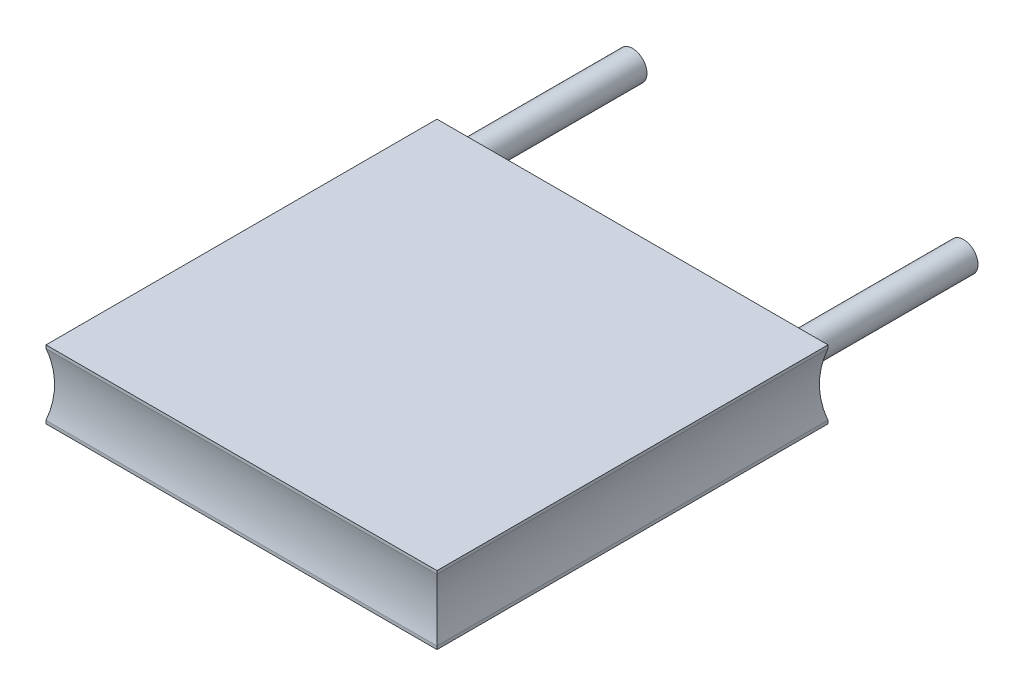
SolidWorks part; units mm, degrees
ref_plane "Front Plane" through (0, 0, 0) normal (0, 0, 1) x (1, 0, 0)
ref_plane "Top Plane" through (0, 0, 0) normal (0, 1, 0) x (1, 0, 0)
ref_plane "Right Plane" through (0, 0, 0) normal (1, 0, 0) x (0, 0, -1)
sketch "Sketch1" plane through (0, 0, 0) normal (0, 1, 0) x (1, 0, 0)
  line L1 (-15, -15) -> (15, -15)
  line L2 (-15, -15) -> (-15, 15)
  line L3 (-15, 15) -> (15, 15)
  line L4 (15, -15) -> (15, 15)
  line L5 (-15, -15) -> (15, 15) construction
  line L6 (-15, 15) -> (15, -15) construction
  point P0 (0, 0)
  dimension "D1" = 30
  dimension "D2" = 30
extrude "Boss-Extrude1" add sketch "Sketch1" along normal mid plane 5.25
sketch "Sketch2" plane through (0, 0, 15) normal (0, 0, 1) x (1, 0, 0)
  line L0 (15, 2.625) -> (15, -2.625) construction
  line L1 (-15, 2.625) -> (15, 2.625)
  line L2 (-15, 2.625) -> (-15, 2.3813)
  line L3 (-15, 2.3813) -> (15, 2.3813)
  line L4 (15, 2.625) -> (15, 2.3813)
  line L5 (-15, 2.625) -> (-15, -2.625) construction
  line L6 (15, -2.625) -> (-15, -2.625)
  line L7 (15, -2.625) -> (15, -2.3813)
  line L8 (15, -2.3813) -> (-15, -2.3813)
  line L9 (-15, -2.625) -> (-15, -2.3813)
  line L10 (-15, 2.3813) -> (-15, -2.3813)
  line L11 (15, 2.3813) -> (15, -2.3813)
  line L12 (-14.6698, 0) -> (-15, 0) construction
  arc A0 (-15, -2.3813) -> (-15, 2.3813) centre (-23.4211, 0) ccw
  arc A1 (15, 2.3813) -> (15, -2.3813) centre (23.4211, 0) ccw
  dimension "D1" = 4.7625
  dimension "D2" = 0.3302
extrude "Cut-Extrude1" cut sketch "Sketch2" against normal through all contours L12 A0 M4 | A0 L12 L10 | A1 M2
sketch "Sketch3" plane through (-15, 0, 0) normal (-1, 0, 0) x (0, 0, 1)
  line L0 (-15, 2.3813) -> (-15, -2.3813)
  line L1 (15, 2.3813) -> (15, -2.3813)
  line L2 (-15, 0) -> (-14.6698, 0) construction
  arc A0 (-15, 2.3813) -> (-15, -2.3813) centre (-23.4211, 0) cw
  arc A1 (15, 2.3813) -> (15, -2.3813) centre (23.4211, 0) ccw
  dimension "D1" = 0.3302
extrude "Cut-Extrude2" cut sketch "Sketch3" against normal through all
sketch "Sketch4" plane through (0, 0, -15) normal (0, 0, -1) x (-1, 0, 0)
  line L0 (0, 0) -> (0, 1.016) construction
  line L1 (0, 1.016) -> (-12.7, 1.016) construction
  line L2 (0, 1.016) -> (12.7, 1.016) construction
  circle A0 centre (-12.7, 1.016) radius 1.1112
  circle A1 centre (12.7, 1.016) radius 1.1112
  dimension "D1" = 2.2225
  dimension "D2" = 25.4
  dimension "D3" = 1.016
extrude "Boss-Extrude2" add sketch "Sketch4" along normal blind 12.7
